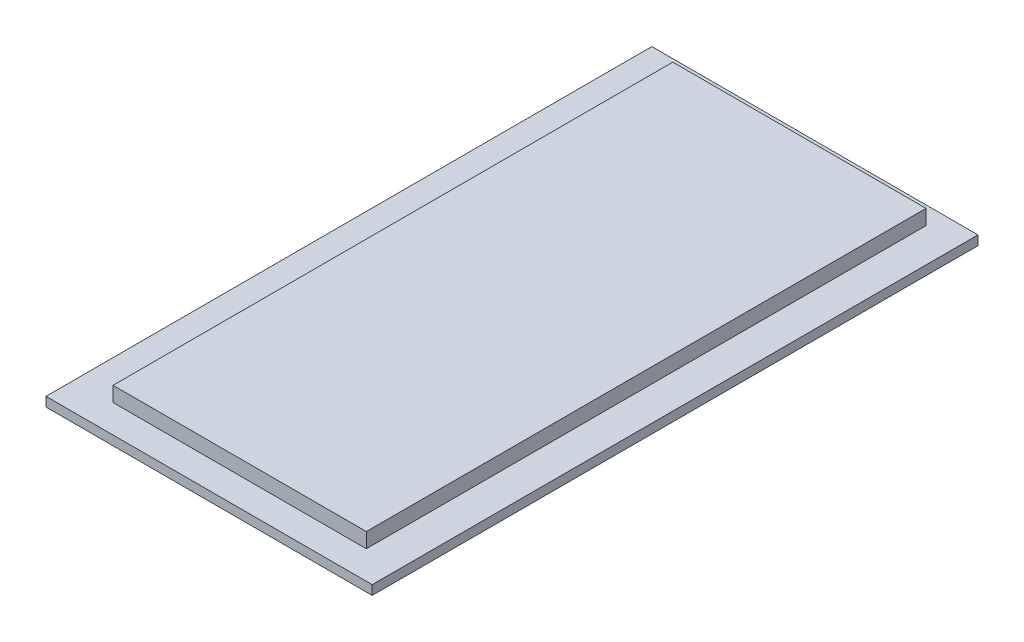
SolidWorks part; units mm, degrees
ref_plane "Front Plane" through (0, 0, 0) normal (0, 0, 1) x (1, 0, 0)
ref_plane "Top Plane" through (0, 0, 0) normal (0, 1, 0) x (1, 0, 0)
ref_plane "Right Plane" through (0, 0, 0) normal (1, 0, 0) x (0, 0, -1)
sketch "Sketch1" plane through (0, 0, 0) normal (0, 1, 0) x (1, 0, 0)
  line L1 (0, 0) -> (88.9, 0)
  line L2 (0, 0) -> (0, 165.1)
  line L3 (0, 165.1) -> (88.9, 165.1)
  line L4 (88.9, 0) -> (88.9, 165.1)
  dimension "D1" = 165.1
  dimension "D2" = 88.9
extrude "Boss-Extrude1" add sketch "Sketch1" along normal blind 2.54
sketch "Sketch2" plane through (0, 2.54, 0) normal (0, 1, 0) x (1, 0, 0)
  line L1 (10.5957, 160.2254) -> (79.6222, 160.2254)
  line L2 (10.5957, 160.2254) -> (10.5957, 7.6752)
  line L3 (10.5957, 7.6752) -> (79.6222, 7.6752)
  line L4 (79.6222, 160.2254) -> (79.6222, 7.6752)
extrude "Boss-Extrude2" add sketch "Sketch2" along normal blind 4.064
